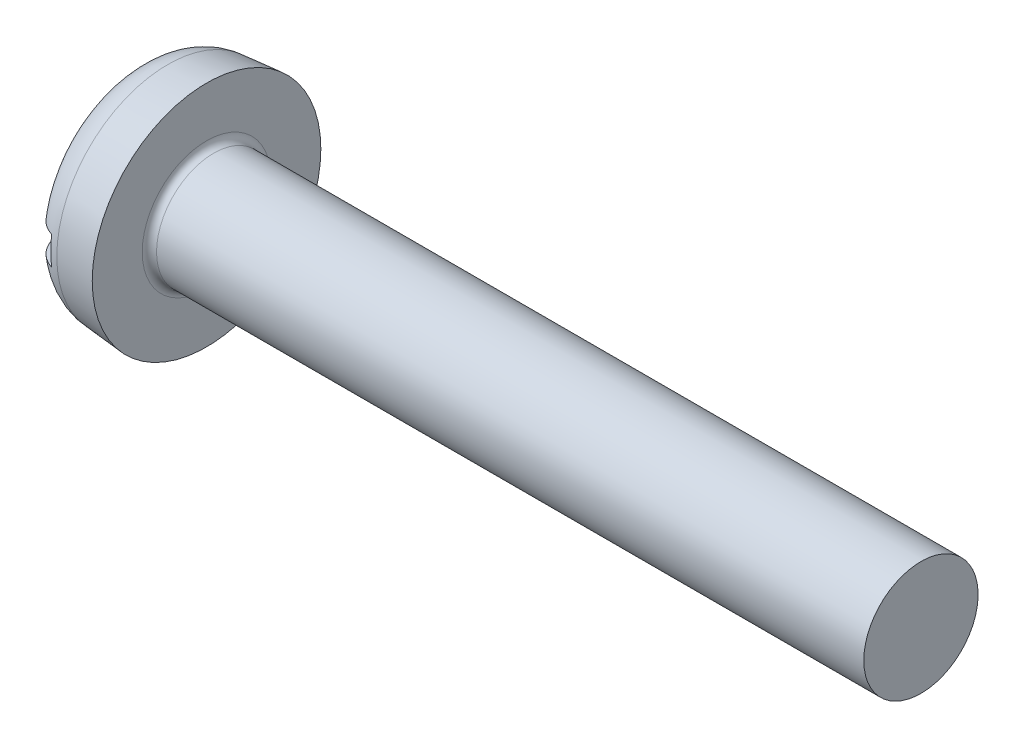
SolidWorks part; units mm, degrees
ref_plane "Front Plane" through (0, 0, 0) normal (0, 0, 1) x (1, 0, 0)
ref_plane "Top Plane" through (0, 0, 0) normal (0, 1, 0) x (1, 0, 0)
ref_plane "Right Plane" through (0, 0, 0) normal (1, 0, 0) x (0, 0, -1)
other "Configuration Table"
sketch "BodySke" plane through (0, 0, 0) normal (0, 0, 1) x (1, 0, 0)
  line L0 (0, 0) -> (19.6365, 0) construction
  line L1 (0, 0) -> (0, 1.5125)
  line L2 (0, 1.5125) -> (1, 1.6)
  line L3 (1, 1.6) -> (1, 0.8)
  line L4 (1, 0.8) -> (11, 0.8)
  line L5 (11, 0.8) -> (11, 0)
  line L6 (11, 0) -> (0, 0)
  line L7 (10.65, 0) -> (10.65, 0.8) construction
  line L8 (1, 0) -> (1, 0.8) construction
  point P12 (11, 0.601)
revolve "BaseBody" add sketch "BodySke" angle 360 about L0
fillet "Fillet1" radius 0.1 1 edges at (1, 0, 0.8)
fillet "Head_Radius" radius 0.5 1 edges at (0, 0, 1.5125)
sketch "SlotSke" plane through (0, 0, 0) normal (1, 0, 0) x (0, 0, -1)
  line L0 (-1.6, 0.2) -> (1.6, -0.2) construction
  line L1 (-1.6, 0.2) -> (1.6, 0.2)
  line L2 (-1.6, 0.2) -> (-1.6, -0.2)
  line L3 (-1.6, -0.2) -> (1.6, -0.2)
  line L4 (1.6, 0.2) -> (1.6, -0.2)
extrude "Slot" cut sketch "SlotSke" along normal blind 0.35
sketch "ThdSchSke" plane through (0, 0, 0) normal (0, 0, 1) x (1, 0, 0)
  line L0 (10.8851, 1.0298) -> (10.8851, 0.8)
  line L1 (10.8851, 1.0298) -> (11.1149, 1.0298)
  line L2 (11.1149, 1.0298) -> (11.1149, 0.8)
  line L3 (11.1149, 0.8) -> (11, 0.601)
  line L4 (11, 0.601) -> (10.8851, 0.8)
  line L5 (1, 0.8) -> (11, 0.8) construction
  line L6 (0, 0) -> (12.5247, 0) construction
  line L7 (0, 0) -> (19.6365, 0) construction
revolve "ThreadSchematic" [suppressed] cut sketch "ThdSchSke" angle 360 about L6
pattern_linear "ThdSchPat" [suppressed]
equation "\"Thread_minor@ThreadCosmetic\" = \"Thread_minor@BodySke\""
equation "\"Thread_length@ThreadCosmetic\" = \"Thread_length@BodySke\""
equation "\"D1@SlotSke\" = \"Head_diameter@BodySke\""
equation "\"Advance@ThdSchPat\" = \"Advance@BodySke\""
equation "\"Tooth_Num@ThdSchPat\" =  int( \"Thread_length@BodySke\" / \"Advance@BodySke\" ) "
